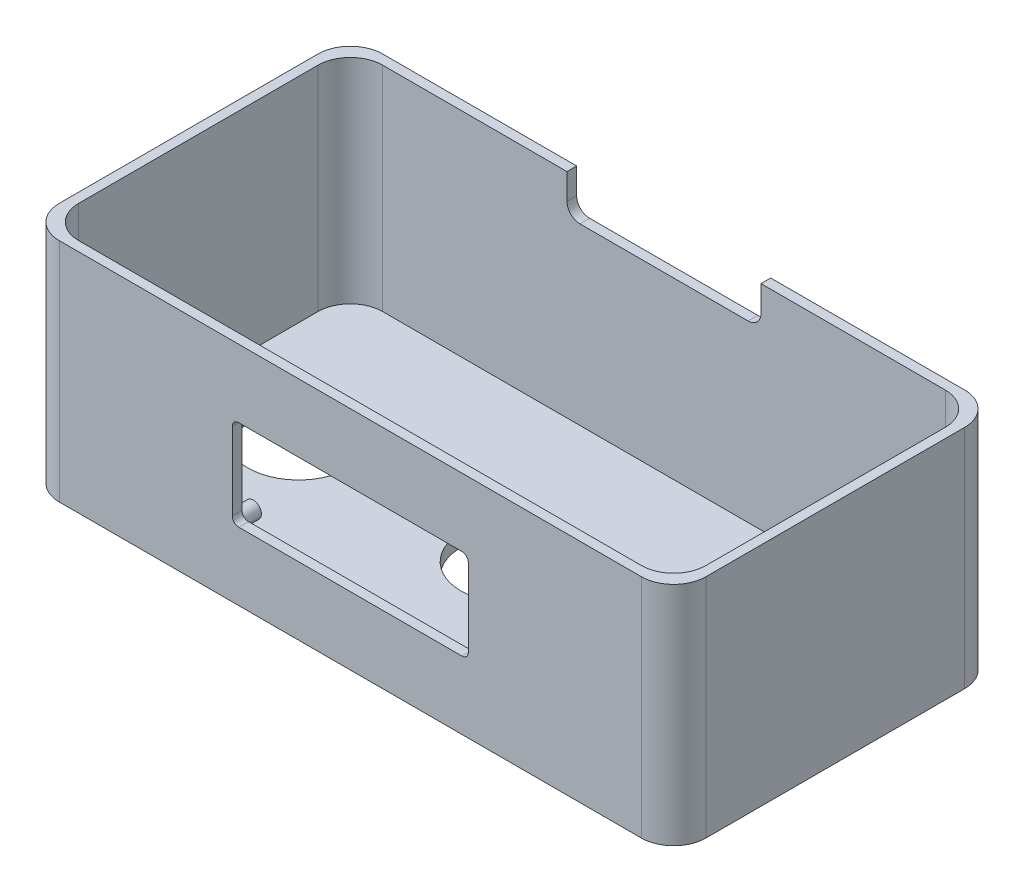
SolidWorks part; units mm, degrees
ref_plane "前视基准面" through (0, 0, 0) normal (0, 0, 1) x (1, 0, 0)
ref_plane "上视基准面" through (0, 0, 0) normal (0, 1, 0) x (1, 0, 0)
ref_plane "右视基准面" through (0, 0, 0) normal (1, 0, 0) x (0, 0, -1)
sketch "草图1" plane through (0, 0, 0) normal (0, 1, 0) x (1, 0, 0)
  line L0 (100, 0) -> (100, -100) construction
  line L1 (10, 0) -> (190, 0)
  line L2 (0, -10) -> (0, -90)
  line L3 (10, -100) -> (190, -100)
  line L4 (200, -10) -> (200, -90)
  line L5 (0, -50) -> (200, -50) construction
  circle A0 centre (100, -50) radius 32.5 construction
  circle A1 centre (100, -50) radius 15.7221
  circle A2 centre (166, -50) radius 32.5 construction
  circle A3 centre (166, -50) radius 15.7221
  circle A4 centre (34, -50) radius 32.5 construction
  circle A5 centre (34, -50) radius 15.7221
  arc A6 (10, 0) -> (0, -10) centre (10, -10) ccw
  arc A7 (0, -90) -> (10, -100) centre (10, -90) ccw
  arc A8 (190, -100) -> (200, -90) centre (190, -90) ccw
  arc A9 (190, 0) -> (200, -10) centre (190, -10) cw
  point P21 (0, 0)
  point P24 (0, -100)
  point P29 (200, 0)
  dimension "D3" = 65
  dimension "D4" = 31.4443
  dimension "D7" = 10
  dimension "D1" = 200
  dimension "D2" = 100
  dimension "D5" = 2
  dimension "D6" = 2
extrude "凸台-拉伸1" add sketch "草图1" along normal blind 70
sketch "草图2" plane through (0, 70, 0) normal (0, 1, 0) x (1, 0, 0)
  line L0 (190, 0) -> (10, 0) construction
  line L1 (13, -3) -> (187, -3)
  line L2 (3, -13) -> (3, -87)
  line L3 (13, -97) -> (187, -97)
  line L4 (197, -13) -> (197, -87)
  line L5 (200, -90) -> (200, -10) construction
  line L6 (10, -100) -> (190, -100) construction
  line L7 (0, -10) -> (0, -90) construction
  arc A0 (3, -87) -> (13, -97) centre (13, -87) ccw
  arc A1 (187, -97) -> (197, -87) centre (187, -87) ccw
  arc A2 (187, -3) -> (197, -13) centre (187, -13) cw
  arc A3 (13, -3) -> (3, -13) centre (13, -13) ccw
  dimension "D5" = 10
  dimension "D1" = 3
  dimension "D2" = 3
  dimension "D3" = 3
  dimension "D4" = 3
extrude "切除-拉伸1" cut sketch "草图2" against normal blind 66
sketch "草图3" plane through (0, 0, 0) normal (0, 0, -1) x (-1, 0, 0)
  line L0 (-100, 70) -> (-100, 0) construction
  line L1 (-190, 70) -> (-10, 70) construction
  line L2 (-190, 0) -> (-10, 0) construction
  line L4 (-130, 70) -> (-70, 70)
  line L5 (-130, 70) -> (-130, 62)
  line L6 (-126, 58) -> (-74, 58)
  line L7 (-70, 70) -> (-70, 62)
  arc A0 (-74, 58) -> (-70, 62) centre (-74, 62) ccw
  arc A1 (-130, 62) -> (-126, 58) centre (-126, 62) ccw
  point P10 (-100, 70)
  point P13 (-70, 58)
  point P16 (-130, 58)
  dimension "D3" = 4
  dimension "D1" = 60
  dimension "D2" = 12
extrude "切除-拉伸2" cut sketch "草图3" against normal blind 66
sketch "草图4" plane through (0, 0, 100) normal (0, 0, 1) x (1, 0, 0)
  line L0 (10, 35) -> (190, 35) construction
  line L1 (10, 70) -> (10, 0) construction
  line L2 (190, 70) -> (190, 0) construction
  line L3 (100, 70) -> (100, 0) construction
  line L4 (10, 70) -> (190, 70) construction
  line L5 (10, 0) -> (190, 0) construction
  line L6 (100, 49) -> (100, 21) construction
  line L7 (65.5, 49) -> (134.5, 49)
  line L8 (63.5, 47) -> (63.5, 23)
  line L9 (65.5, 21) -> (134.5, 21)
  line L10 (136.5, 47) -> (136.5, 23)
  line L11 (63.5, 35) -> (136.5, 35) construction
  arc A0 (65.5, 49) -> (63.5, 47) centre (65.5, 47) ccw
  arc A1 (63.5, 23) -> (65.5, 21) centre (65.5, 23) ccw
  arc A2 (134.5, 21) -> (136.5, 23) centre (134.5, 23) ccw
  arc A3 (134.5, 49) -> (136.5, 47) centre (134.5, 47) cw
  point P22 (63.5, 49)
  point P27 (136.5, 21)
  point P30 (136.5, 49)
  dimension "D3" = 2
  dimension "D1" = 73
  dimension "D2" = 28
extrude "切除-拉伸3" cut sketch "草图4" against normal blind 10
sketch "草图5" plane through (0, 0, 97) normal (0, 0, -1) x (-1, 0, 0)
  line L0 (-100, 70) -> (-100, 4) construction
  line L1 (-13, 70) -> (-187, 70) construction
  line L2 (-13, 4) -> (-187, 4) construction
  line L3 (-136.5, 35) -> (-63.5, 35) construction
  line L4 (-59.5, 53.5) -> (-59.5, 16.5) construction
  line L6 (-100, 53.5) -> (-100, 16.5) construction
  line L7 (-140.5, 53.5) -> (-59.5, 53.5) construction
  line L8 (-140.5, 53.5) -> (-140.5, 16.5) construction
  line L9 (-140.5, 16.5) -> (-59.5, 16.5) construction
  line L10 (-59.5, 53.5) -> (-59.5, 16.5) construction
  line L11 (-140.5, 35) -> (-59.5, 35) construction
  line L12 (-136.5, 23) -> (-136.5, 47) construction
  line L13 (-63.5, 47) -> (-63.5, 23) construction
  circle A0 centre (-139, 50.9686) radius 2.5
  arc A1 (-134.5, 49) -> (-136.5, 47) centre (-134.5, 47) ccw construction
  circle A2 centre (-139, 50.9686) radius 1.5
  circle A3 centre (-139, 19.0314) radius 1.5
  circle A4 centre (-139, 19.0314) radius 2.5
  circle A5 centre (-61, 19.0314) radius 2.5
  circle A6 centre (-61, 19.0314) radius 1.5
  circle A7 centre (-61, 50.9686) radius 1.5
  circle A8 centre (-61, 50.9686) radius 2.5
  dimension "D3" = 5
  dimension "D6" = 3
  dimension "D1" = 81
  dimension "D2" = 37
  dimension "D4" = 6
  dimension "D5" = 3
extrude "凸台-拉伸2" add sketch "草图5" along normal blind 6
